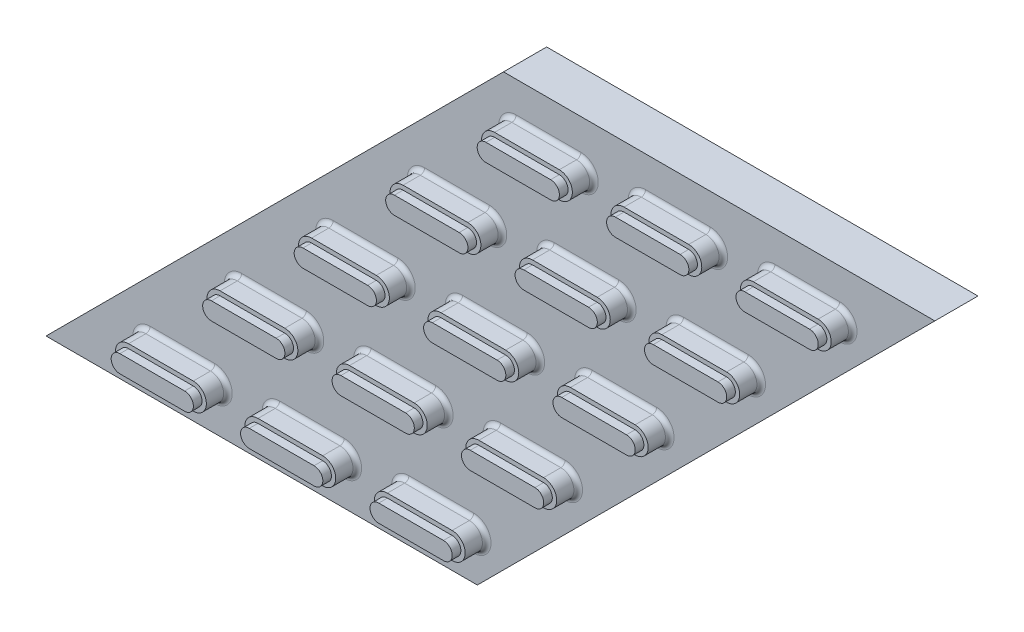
SolidWorks part; units mm, degrees
ref_plane "Front Plane" through (0, 0, 0) normal (0, 0, 1) x (1, 0, 0)
ref_plane "Top Plane" through (0, 0, 0) normal (0, 1, 0) x (1, 0, 0)
ref_plane "Right Plane" through (0, 0, 0) normal (1, 0, 0) x (0, 0, -1)
sketch "Sketch1" plane through (0, 0, 0) normal (0, 0, 1) x (1, 0, 0)
  line L0 (0, 0) -> (100, 0)
  line L1 (0, 0) -> (106.066, 106.066)
  line L2 (100, 0) -> (206.066, 106.066)
  line L3 (106.066, 106.066) -> (206.066, 106.066)
  dimension "D1" = 100
  dimension "D2" = 150
  dimension "D3" = 45
extrude "Extrude1" add sketch "Sketch1" along normal mid plane 10
sketch "Sketch2" plane through (0, 0, 5) normal (0, 0, 1) x (1, 0, 0)
  line L0 (24.1421, 13.0314) -> (39.1421, 13.0314)
  line L1 (39.1421, 6.9686) -> (24.1421, 6.9686)
  line L3 (0, 0) -> (100, 0) construction
  line L4 (106.066, 106.066) -> (0, 0) construction
  arc A0 (39.1421, 13.0314) -> (39.1421, 6.9686) centre (39.1421, 10) cw
  arc A1 (24.1421, 6.9686) -> (24.1421, 13.0314) centre (24.1421, 10) cw
  dimension "D2" = 3.0314
  dimension "D1" = 15
  dimension "D3" = 10
  dimension "D4" = 10
extrude "Extrude2" add sketch "Sketch2" along normal blind 5
fillet "Fillet1" radius 1 4 edges at (21.1107, 10, 5) (31.6421, 13.0314, 5) (42.1736, 10, 5) (31.6421, 6.9686, 5)
sketch "Sketch3" plane through (0, 0, 10) normal (0, 0, 1) x (1, 0, 0)
  line L6 (24.1421, 7.9686) -> (39.1421, 7.9686)
  line L7 (39.1421, 12.0314) -> (24.1421, 12.0314)
  line L8 (24.1421, 7.9686) -> (39.1421, 7.9686)
  line L9 (39.1421, 12.0314) -> (24.1421, 12.0314)
  arc A6 (24.1421, 12.0314) -> (24.1421, 7.9686) centre (24.1421, 10) ccw
  arc A7 (39.1421, 7.9686) -> (39.1421, 12.0314) centre (39.1421, 10) ccw
  arc A8 (24.1421, 12.0314) -> (24.1421, 7.9686) centre (24.1421, 10) ccw
  arc A9 (39.1421, 7.9686) -> (39.1421, 12.0314) centre (39.1421, 10) ccw
  dimension "D1" = 1
extrude "Extrude3" add sketch "Sketch3" along normal blind 2
pattern_linear "LPattern1" count 3 spacing 30 along (1, 0, 0) count 5 spacing 30 along (0.7071, 0.7071, 0) of "Fillet1", "Extrude2", "Extrude3"
